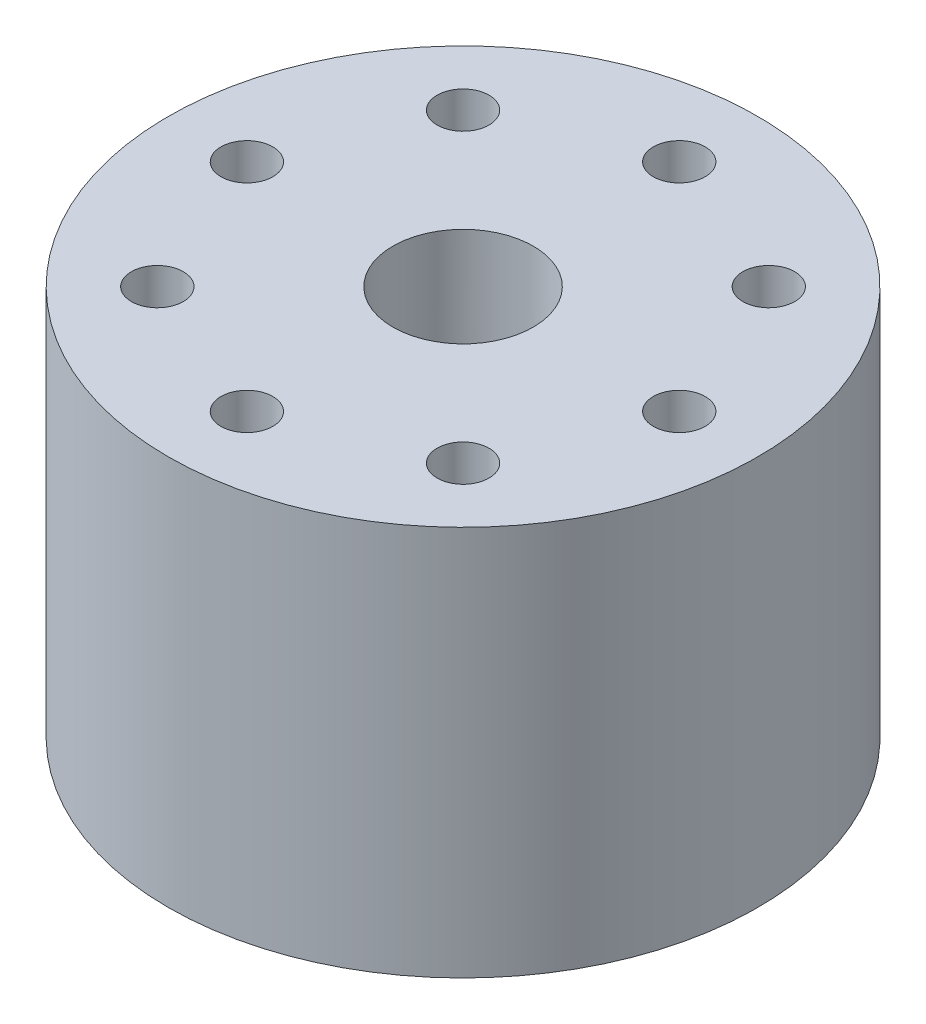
SolidWorks part; units mm, degrees
ref_plane "Front Plane" through (0, 0, 0) normal (0, 0, 1) x (1, 0, 0)
ref_plane "Top Plane" through (0, 0, 0) normal (0, 1, 0) x (1, 0, 0)
ref_plane "Right Plane" through (0, 0, 0) normal (1, 0, 0) x (0, 0, -1)
sketch "Sketch1" plane through (0, 0, 0) normal (0, 1, 0) x (1, 0, 0)
  circle A0 centre (0, 0) radius 37.5
  dimension "D1" = 75
extrude "Outer Cylinder" add sketch "Sketch1" along normal blind 49.65
sketch "Sketch2" plane through (0, 49.65, 0) normal (0, 1, 0) x (1, 0, 0)
  circle A0 centre (0, 0) radius 8.93
  dimension "D1" = 17.86
extrude "NPT Hole" cut sketch "Sketch2" against normal blind 23
sketch "Sketch3" plane through (0, 0, 0) normal (0, -1, 0) x (1, 0, 0)
  circle A0 centre (0, 0) radius 11
  dimension "D1" = 22
extrude "Outer Leaflet Diameter" cut sketch "Sketch3" against normal blind 5
sketch "Sketch4" plane through (0, 0, 0) normal (0, -1, 0) x (1, 0, 0)
  circle A0 centre (0, 0) radius 15
  dimension "D1" = 30
extrude "Depth" cut sketch "Sketch4" against normal blind 3.15
ref_plane "Plane1" through (0, 3.15, 0) normal (0, -1, 0) x (-1, 0, 0)
sketch "Sketch6" plane through (0, 0, 0) normal (0, 0, 1) x (1, 0, 0)
  line L0 (0, 3.15) -> (-11, 3.15)
  line L1 (-15, 3.15) -> (15, 3.15) construction
  line L2 (0, 3.15) -> (0, 18.77)
  line L3 (0, 18.77) -> (-11, 18.77)
  spline S0 degree 2 poles (-11, 18.77) (-17.6, 10.96) (-11, 3.15) knots 0 0 0 1 1 1
revolve "Aortic Root" cut sketch "Sketch6" angle 360 about L2
ref_plane "Plane3" through (0, 26.65, 0) normal (0, 1, 0) x (1, 0, 0)
ref_plane "Plane5" through (0, 18.77, 0) normal (0, -1, 0) x (-1, 0, 0)
sketch "Sketch8" plane through (0, 0, 0) normal (0, 0, 1) x (1, 0, 0)
  line L0 (0, 26.65) -> (0, 18.77)
  line L1 (8.93, 26.65) -> (-8.93, 26.65) construction
  line L2 (-11, 18.77) -> (11, 18.77) construction
  line L3 (0, 18.77) -> (-11, 18.77)
  line L4 (-11, 18.77) -> (-11, 26.65)
  line L5 (-11, 26.65) -> (0, 26.65)
revolve "Ascending Aorta" cut sketch "Sketch8" angle 360 about L0
sketch "Sketch9" plane through (0, 49.65, 0) normal (0, 1, 0) x (1, 0, 0)
  line L0 (0, 0) -> (0, -27.5) construction
  line L1 (0, 0) -> (-19.4454, -19.4454) construction
  circle A0 centre (0, -27.5) radius 3.3
  circle A1 centre (0, 0) radius 27.5
  circle A2 centre (-19.4454, -19.4454) radius 3.3
  circle A3 centre (-27.5, 0) radius 3.3
  circle A4 centre (-19.4454, 19.4454) radius 3.3
  circle A5 centre (0, 27.5) radius 3.3
  circle A6 centre (19.4454, 19.4454) radius 3.3
  circle A7 centre (27.5, 0) radius 3.3
  circle A8 centre (19.4454, -19.4454) radius 3.3
  dimension "D1" = 6.6
  dimension "D3" = 55
  dimension "D2" = 27.5
  dimension "D5" = 45
  dimension "D4" = 8
extrude "Bolt Holes" cut sketch "Sketch9" against normal through all contours A1 A8 | A1 A7 | A1 A6 | A1 A6 | A1 A5 | A1 A5 | A1 A4 | A1 A4 | A1 A3 | A1 A3 | A1 A2 | A1 A2 | A0 A1 | A1 A0 | A1 A8
chamfer "Chamfer3" distance 2 angle 50 2 edges at (-11, 26.65, 0) (0, 26.65, 8.93)
equation "\"A\"= 22"
equation "\"Outer Leaflet Diameter\"= \"A\""
equation "\"Aortic Root Height\"= .71 * \"A\""
equation "\"D2@Sketch6\"=\"A\"/2"
equation "\"D3@Sketch6\"= \"A\" / 2"
equation "\"Max Diameter Height\"= \"A\" * ( .71 / 2 )"
equation "\"Max Diameter\"= \"A\" * ( .65 )"
equation "\"D2@Sketch8\"=\"A\"/2"
